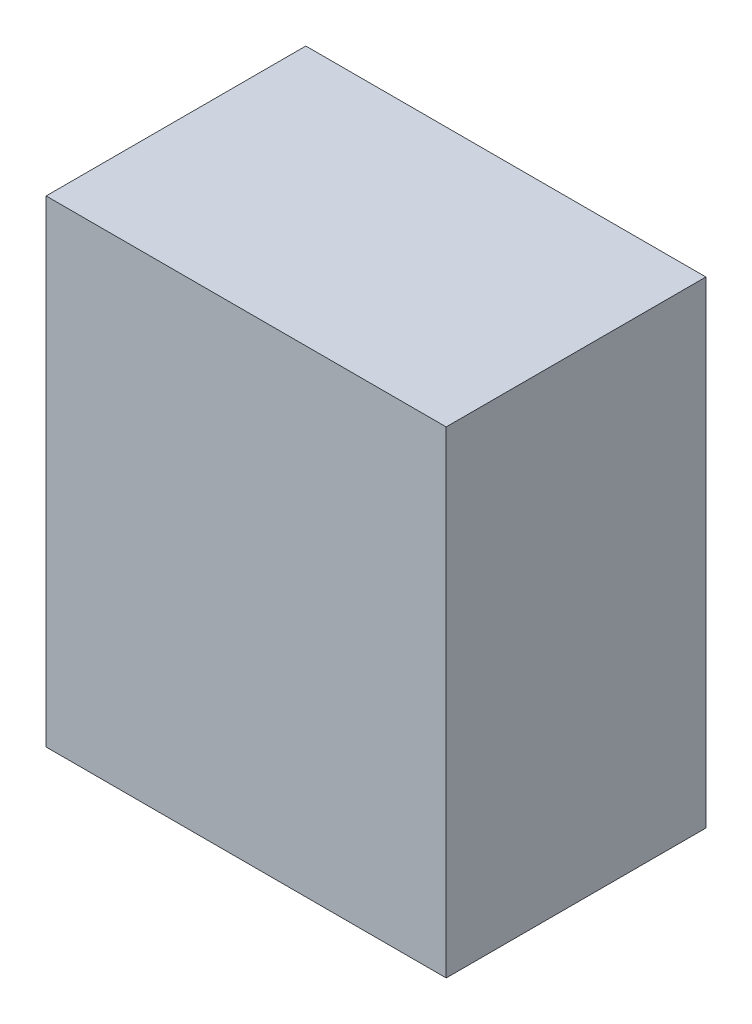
SolidWorks part; units mm, degrees
ref_plane "Front Plane" through (0, 0, 0) normal (0, 0, 1) x (1, 0, 0)
ref_plane "Top Plane" through (0, 0, 0) normal (0, 1, 0) x (1, 0, 0)
ref_plane "Right Plane" through (0, 0, 0) normal (1, 0, 0) x (0, 0, -1)
sketch "Sketch1" plane through (0, 0, 0) normal (0, 1, 0) x (1, 0, 0)
  line L1 (-28.5, 18.5) -> (28.5, 18.5)
  line L2 (-28.5, 18.5) -> (-28.5, -18.5)
  line L3 (-28.5, -18.5) -> (28.5, -18.5)
  line L4 (28.5, 18.5) -> (28.5, -18.5)
  line L5 (-28.5, 18.5) -> (28.5, -18.5) construction
  line L6 (-28.5, -18.5) -> (28.5, 18.5) construction
  point P0 (0, 0)
  dimension "D1" = 57
  dimension "D2" = 37
extrude "Boss-Extrude1" add sketch "Sketch1" along normal blind 68
